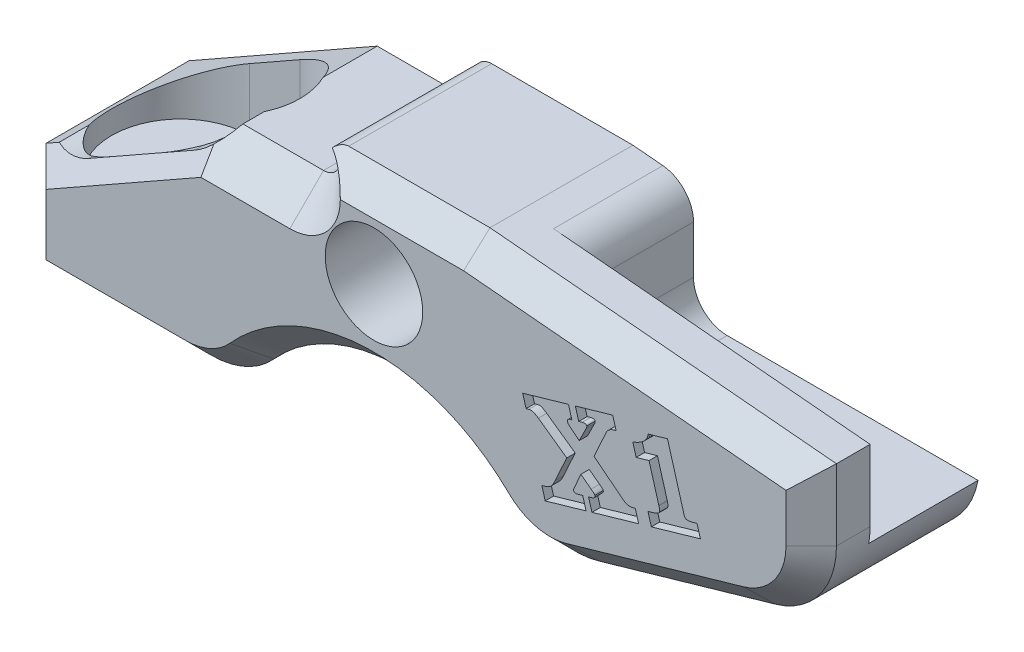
SolidWorks part; units mm, degrees
ref_plane "Спереди" through (0, 0, 0) normal (0, 0, 1) x (1, 0, 0)
ref_plane "Сверху" through (0, 0, 0) normal (0, 1, 0) x (1, 0, 0)
ref_plane "Справа" through (0, 0, 0) normal (1, 0, 0) x (0, 0, -1)
sketch "Эскиз1" plane through (0, 0, 0) normal (0, 0, 1) x (1, 0, 0)
  line L0 (-8.6603, -10) -> (-21, -10)
  line L1 (-21, -10) -> (-21, -4)
  line L2 (-21, -4) -> (-5.4, 4.852)
  line L3 (-5.4, 4.852) -> (5.4, 4.852)
  line L4 (5.4, 4.852) -> (26, 3)
  line L5 (26, 3) -> (26, -5)
  line L6 (8.6603, -10) -> (26, -5)
  line L8 (0, 12.7413) -> (0, 0) construction
  line L9 (0, 0) -> (28.6283, 0) construction
  circle A0 centre (0, 0) radius 1.65
  arc A1 (8.6603, -10) -> (-8.6603, -10) centre (0, -15) ccw
  point P5 (0, 4.852)
  dimension "D1" = 3.3
  dimension "D3" = 10
  dimension "D4" = 15
  dimension "D2" = 21
  dimension "D5" = 26
  dimension "D6" = 10
  dimension "D7" = 4.852
  dimension "D8" = 6
  dimension "D9" = 3
  dimension "D10" = 8
  dimension "D11" = 10.8
extrude "Бобышка-Вытянуть1" add sketch "Эскиз1" along normal blind 10
fillet "Скругление1" radius 5 3 edges at (8.6603, -10, 5) (-8.6603, -10, 5) (26, -5, 5)
chamfer "Фаска1" distance 1.5 angle 45 11 edges at (-21, -7, 10) (0, 4.852, 10) (-13.2, 0.426, 10) (15.7, 3.926, 10) (26, 0.881, 10) (-16.0902, -10, 10) (17.1266, -7.5587, 10) (-9.1391, -9.5644, 10) (9.2624, -9.1196, 10) (-0.3364, -5.0057, 10) (24.9954, -4.2442, 10)
sketch "Эскиз4" plane through (0, 4.852, 0) normal (0, 1, 0) x (1, 0, 0)
  line L0 (0, 0) -> (0, -14.1418) construction
  line L1 (5.4, 0) -> (-5.4, 0) construction
  line L2 (-16.5, -5) -> (-13.5, -5) construction
  line L3 (-16.5, -3.4) -> (-13.5, -3.4)
  line L4 (-16.5, -6.6) -> (-13.5, -6.6)
  line L5 (0, 0) -> (-27.8921, 0) construction
  arc A0 (-16.5, -3.4) -> (-16.5, -6.6) centre (-16.5, -5) ccw
  arc A1 (-13.5, -6.6) -> (-13.5, -3.4) centre (-13.5, -5) ccw
  point P6 (-15, -5)
  dimension "D1" = 1.6
  dimension "D2" = 3
  dimension "D3" = 5
  dimension "D4" = 15
extrude "Вырез-Вытянуть3" cut sketch "Эскиз4" against normal through all
sketch "Эскиз5" plane through (0, 4.852, 0) normal (0, 1, 0) x (1, 0, 0)
  line L8 (-16.5, -9.1) -> (-13.5, -9.1)
  line L9 (-13.5, -0.9) -> (-16.5, -0.9)
  line L10 (-16.5, -9.1) -> (-13.5, -9.1)
  line L11 (-13.5, -0.9) -> (-16.5, -0.9)
  arc A6 (-16.5, -0.9) -> (-16.5, -9.1) centre (-16.5, -5) ccw
  arc A7 (-13.5, -9.1) -> (-13.5, -0.9) centre (-13.5, -5) ccw
  arc A8 (-16.5, -0.9) -> (-16.5, -9.1) centre (-16.5, -5) ccw
  arc A9 (-13.5, -9.1) -> (-13.5, -0.9) centre (-13.5, -5) ccw
  dimension "D1" = 2.5
extrude "Вырез-Вытянуть4" cut sketch "Эскиз5" against normal blind 10
sketch "Эскиз7" plane through (0, 0, 10) normal (0, 0, 1) x (1, 0, 0)
  line L0 (-20.2184, -3.5565) -> (-20.2184, -4.2464)
  line L1 (-20.2184, -4.2464) -> (-9.7816, 1.6759)
  line L2 (-9.7816, 1.6759) -> (-9.7816, 2.3657)
  line L3 (-9.7816, 2.3657) -> (-20.2184, -3.5565)
  line L4 (-11.3646, 1.4675) -> (-5.4, 4.852) construction
  line L5 (-21, -4) -> (-18.6354, -2.6583) construction
  line L6 (-16.5, -2.1364) -> (-13.5, -0.4341) construction
  line L7 (-15, -0.5954) -> (-15, -1.2853) construction
  line L8 (0, 0) -> (0, -8.5882) construction
  dimension "D1" = 12
  dimension "D2" = 15
extrude "Вырез-Вытянуть6" cut sketch "Эскиз7" against normal blind 5
fillet "Скругление3" radius 5 2 edges at (-9.7816, 1.6759, 7.9136) (-20.2184, -4.2464, 7.9136)
sketch "Эскиз8" plane through (0, 0, 0) normal (0, 0, -1) x (-1, 0, 0)
  line L0 (-26, -1.2381) -> (-26, 3) construction
  line L1 (-26, -2.148) -> (-9, -2.148)
  line L2 (-26, -2.148) -> (-26, 4.852)
  line L3 (-26, 4.852) -> (-9, 4.852)
  line L4 (-9, -2.148) -> (-9, 4.852)
  line L5 (-5.4, 4.852) -> (5.4, 4.852) construction
  dimension "D1" = 17
  dimension "D2" = 7
extrude "Вырез-Вытянуть7" cut sketch "Эскиз8" against normal blind 6.5
fillet "Скругление4" radius 2 2 edges at (9, 4.5283, 3.25) (9, -2.148, 3.25)
sketch "Эскиз9" plane through (-21, 0, 0) normal (-1, 0, 0) x (0, 0, 1)
  line L0 (10, 3.352) -> (10, -4.8735) construction
  line L1 (0, 4.852) -> (10, 4.852)
  line L2 (0, 4.852) -> (0, 2.352)
  line L3 (0, 2.352) -> (10, 2.352)
  line L4 (10, 4.852) -> (10, 2.352)
  dimension "D1" = 2.5
extrude "Вырез-Вытянуть8" cut sketch "Эскиз9" against normal blind 17
fillet "Скругление5" radius 1 2 edges at (-4, 2.352, 5) (-4, 4.852, 4.25)
chamfer "Фаска2" distance 2 angle 45 2 edges at (-4.2929, 2.6449, 10) (-5.8832, 2.352, 10)
sketch "Эскиз10" plane through (0, 0, 10) normal (0, 0, 1) x (1, 0, 0)
  circle A0 centre (0, 0) radius 2.9
  dimension "D1" = 5.8
extrude "Вырез-Вытянуть9" cut sketch "Эскиз10" against normal blind 5
sketch "Эскиз11" plane through (0, 0, 10) normal (0, 0, 1) x (1, 0, 0)
  line L0 (10.2526, -6.054) -> (22.9449, -2.3941) construction
  line L1 (11.4523, -7.6338) -> (21.9697, -4.601) construction
  text T0 "X1" font "Clarendon Blk BT" height 5
extrude "Вырез-Вытянуть10" cut sketch "Эскиз11" against normal blind 0.5
